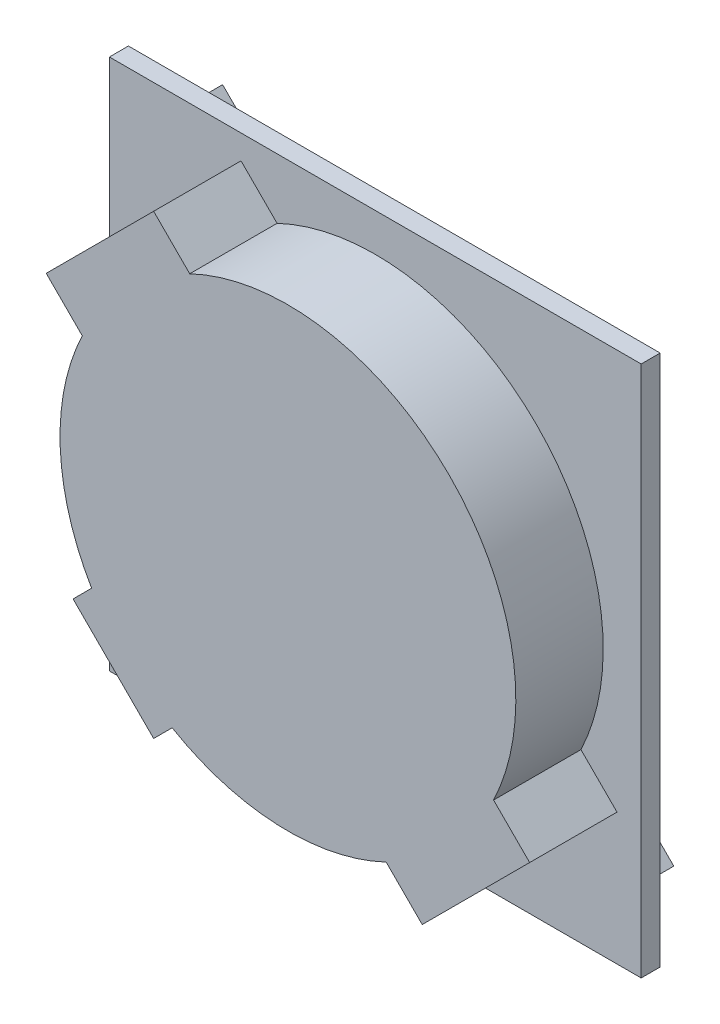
SolidWorks part; units mm, degrees
ref_plane "Plan de face" through (0, 0, 0) normal (0, 0, 1) x (1, 0, 0)
ref_plane "Plan de dessus" through (0, 0, 0) normal (0, 1, 0) x (1, 0, 0)
ref_plane "Plan de droite" through (0, 0, 0) normal (1, 0, 0) x (0, 0, -1)
sketch "Esquisse1" plane through (0, 0, 0) normal (0, 0, 1) x (1, 0, 0)
  line L5 (0, 0) -> (14, 0)
  line L6 (0, 0) -> (0, 14)
  line L7 (0, 14) -> (14, 14)
  line L8 (14, 0) -> (14, 14)
  dimension "D1" = 14
  dimension "D2" = 14
extrude "Boss.-Extru.1" add sketch "Esquisse1" along normal blind 0.5
sketch "Esquisse2" plane through (0, 0, 0.5) normal (0, 0, 1) x (1, 0, 0)
  line L0 (0, 7) -> (14, 7) construction
  line L1 (0, 14) -> (0, 0) construction
  line L2 (14, 0) -> (14, 14) construction
  line L3 (7, 14) -> (7, 0) construction
  line L4 (14, 14) -> (0, 14) construction
  line L5 (0, 0) -> (14, 0) construction
  line L6 (0, 14) -> (14, 0) construction
  line L7 (0.636, 10.5355) -> (1.5858, 9.5858)
  line L12 (3.4645, 13.364) -> (4.4142, 12.4142)
  line L13 (14, 14) -> (0, 0) construction
  line L14 (3.4645, 13.364) -> (0.636, 10.5355)
  line L15 (13.364, 3.4645) -> (10.5355, 0.636)
  line L16 (1.4142, 15.4142) -> (15.4142, 1.4142) construction
  line L17 (-1.4142, 12.5858) -> (12.5858, -1.4142) construction
  line L18 (9.5858, 1.5858) -> (10.5355, 0.636)
  line L20 (12.4142, 4.4142) -> (13.364, 3.4645)
  line L22 (1.3431, 3.4645) -> (3.4645, 1.3431)
  line L23 (1.8314, 3.9527) -> (1.3431, 3.4645)
  line L26 (3.9527, 1.8314) -> (3.4645, 1.3431)
  arc A0 (12.4142, 4.4142) -> (4.4142, 12.4142) centre (7, 7) ccw
  arc A1 (1.5858, 9.5858) -> (1.8314, 3.9527) centre (7, 7) ccw
  arc A2 (3.9527, 1.8314) -> (9.5858, 1.5858) centre (7, 7) ccw
  point P31 (8.4142, 8.4142)
  point P32 (5.5858, 5.5858)
  point P34 (12.9393, 15.0607)
  point P36 (-1.0607, 1.0607)
  point P37 (15.0607, 12.9393)
  point P38 (1.0607, -1.0607)
  point P41 (2.4038, 2.4038)
  dimension "D1" = 12
  dimension "D2" = 2
  dimension "D3" = 2
  dimension "D4" = 7
  dimension "D5" = 6.5
  dimension "D6" = 3
extrude "Boss.-Extru.2" add sketch "Esquisse2" along normal blind 2.3
sketch "Esquisse3" plane through (0, 0, 0) normal (0, 0, -1) x (-1, 0, 0)
  line L0 (0, 14) -> (-14, 0) construction
  line L1 (0, 0) -> (-14, 0) construction
  line L2 (-14, 0) -> (-14, 14) construction
  line L3 (-14, 14) -> (0, 0) construction
  line L4 (-1.3431, 9.1213) -> (-4.8787, 12.6569)
  line L5 (-4.8787, 12.6569) -> (-8.4142, 9.1213)
  line L6 (-8.4142, 9.1213) -> (-4.8787, 5.5858)
  line L7 (-1.3431, 9.1213) -> (-4.8787, 5.5858)
  point P16 (-6.6464, 7.3536)
  point P17 (-3.1109, 10.8891)
  dimension "D1" = 5
  dimension "D2" = 0.5
  dimension "D3" = 2.5
extrude "Boss.-Extru.3" add sketch "Esquisse3" along normal blind 1
chamfer "Chanfrein1" distance 1 angle 45 4 edges at (4.8787, 5.5858, -0.5) (1.3431, 9.1213, -0.5) (4.8787, 12.6569, -0.5) (8.4142, 9.1213, -0.5)
sketch "Esquisse4" plane through (0, 0, -1) normal (0, 0, -1) x (-1, 0, 0)
  line L0 (-6.6464, 10.8891) -> (-3.1109, 7.3536) construction
  line L1 (-5.5858, 11.9497) -> (-7.7071, 9.8284) construction
  line L2 (-4.1716, 6.2929) -> (-2.0503, 8.4142) construction
  circle A0 centre (-4.8787, 9.1213) radius 1
  dimension "D1" = 2
extrude "Boss.-Extru.4" add sketch "Esquisse4" along normal blind 0.5
sketch "Esquisse6" plane through (0, 0, 0) normal (0, 0, -1) x (-1, 0, 0)
  line L0 (-14, 14) -> (0, 0) construction
  line L1 (0, 14) -> (-14, 0) construction
  circle A0 centre (-7, 7) radius 7 construction
sketch "Esquisse5" plane through (0, 0, 0) normal (0, 0, -1) x (-1, 0, 0)
  line L0 (0, 14) -> (-14, 0) construction
  line L1 (0, 0) -> (-14, 14) construction
  line L2 (-0.1414, 12.0201) -> (-1.9799, 13.8586)
  line L3 (-1.9799, 13.8586) -> (-2.5456, 13.2929)
  line L4 (-2.5456, 13.2929) -> (-0.7071, 11.4544)
  line L5 (-0.1414, 12.0201) -> (-0.7071, 11.4544)
  line L6 (-1.9799, 0.1414) -> (-0.1414, 1.9799)
  line L7 (-0.1414, 1.9799) -> (-0.7071, 2.5456)
  line L8 (-0.7071, 2.5456) -> (-2.5456, 0.7071)
  line L9 (-1.9799, 0.1414) -> (-2.5456, 0.7071)
  line L10 (-13.8586, 1.9799) -> (-12.0201, 0.1414)
  line L11 (-12.0201, 0.1414) -> (-11.4544, 0.7071)
  line L12 (-11.4544, 0.7071) -> (-13.2929, 2.5456)
  line L13 (-13.8586, 1.9799) -> (-13.2929, 2.5456)
  point P14 (-1.6263, 12.3737)
  point P15 (-1.0607, 12.9393)
  point P25 (-7, 7)
  dimension "D1" = 0.8
  dimension "D2" = 1.5
  dimension "D3" = 1.3
  dimension "D4" = 3
extrude "Boss.-Extru.5" add sketch "Esquisse5" along normal blind 0.5
